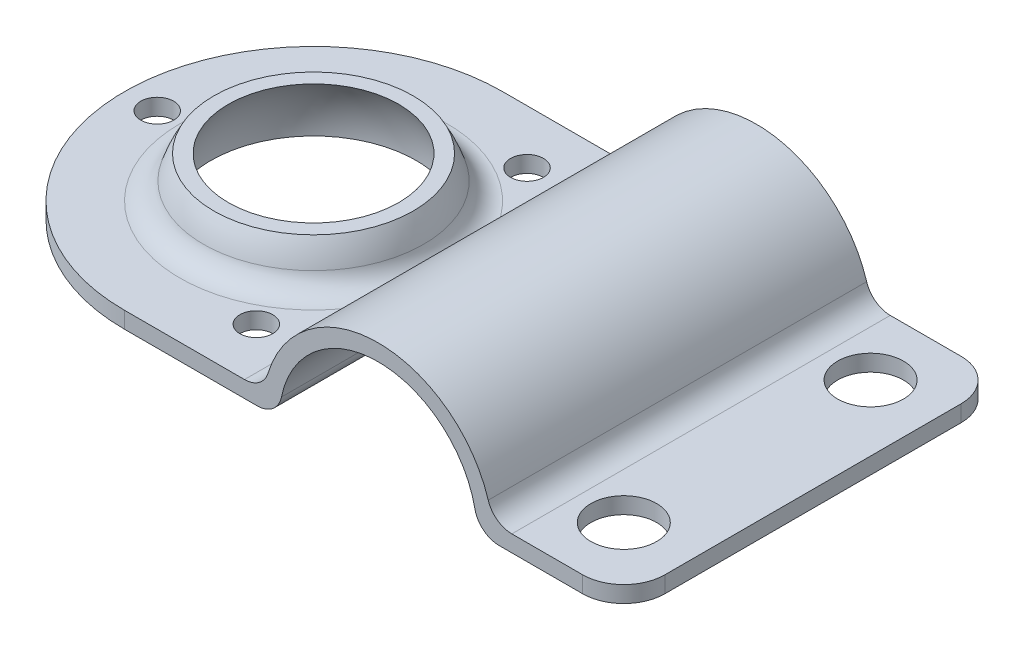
SolidWorks part; units mm, degrees
ref_plane "Face" through (0, 0, 0) normal (0, 0, 1) x (1, 0, 0)
ref_plane "Dessus" through (0, 0, 0) normal (0, 1, 0) x (1, 0, 0)
ref_plane "Droite" through (0, 0, 0) normal (1, 0, 0) x (0, 0, -1)
sketch "Esquisse1" plane through (0, 0, 0) normal (0, 0, 1) x (1, 0, 0)
  line L0 (-54.0174, 0) -> (-14.0174, 0)
  line L1 (13.6954, 0) -> (29.6954, 0)
  arc A0 (13.6954, 0) -> (-14.0174, 0) centre (-0.161, -2) ccw
  dimension "D1" = 2
  dimension "D4" = 28
  dimension "D2" = 16
  dimension "D3" = 40
extrude "Base-Extru.-Mince" add sketch "Esquisse1" along normal blind 46 thin
sketch "Esquisse2" plane through (0, 0, 0) normal (0, 1, 0) x (-1, 0, 0)
  line L0 (54.0174, 46) -> (14.0174, 46) construction
  line L1 (54.0174, 0) -> (14.0174, 0) construction
  line L2 (54.0174, 46) -> (54.0174, 0) construction
  line L3 (-29.6954, 0) -> (-29.6954, 46)
  line L4 (-29.6954, 46) -> (31.0174, 46)
  line L5 (31.0174, 0) -> (-29.6954, 0)
  arc A0 (31.0174, 0) -> (31.0174, 46) centre (31.0174, 23) ccw
extrude "Enlèv. mat.-Extru.5" cut sketch "Esquisse2" against normal blind 46 flip side to cut
fillet "Congé2" radius 3
fillet "Congé3" radius 3
fillet "Congé4" radius 3
fillet "Congé5" radius 5
sketch "Esquisse3" plane through (0, -2, 0) normal (0, -1, 0) x (1, 0, 0)
  line L0 (-17.0174, 23) -> (-24.9033, 23) construction
  line L1 (-17.0174, 23) -> (-45.0174, 23)
  arc A0 (-45.0174, 23) -> (-17.0174, 23) centre (-31.0174, 23) ccw
  dimension "D1" = 28
revolve "Boss.-Révol.1" add sketch "Esquisse3" angle 180 about L0
sketch "Esquisse4" plane through (0, -2, 0) normal (0, -1, 0) x (1, 0, 0)
  line L0 (-28.1823, 23) -> (-30.8952, 23) construction
  line L3 (-18.5174, 23) -> (-43.5174, 23)
  arc A0 (-43.5174, 23) -> (-18.5174, 23) centre (-31.0174, 23) ccw
  dimension "D1" = 25
revolve "Enlèvement de matière-Révolution1" cut sketch "Esquisse4" angle 360 about L0
fillet "Congé7" radius 3
sketch "Esquisse9" plane through (0, 0, 0) normal (0, 1, 0) x (1, 0, 0)
  line L0 (-31.0174, -53.7493) -> (-31.0174, 11.3537) construction
ref_plane "Plan1" through (-31.0174, 0, 0) normal (-1, 0, 0) x (0, 0, 1)
sketch "Esquisse10" plane through (-31.0174, 0, 0) normal (-1, 0, 0) x (0, 0, 1)
  line L0 (46, 2.1176) -> (46, 12) construction
  line L1 (0, 12) -> (46, 12)
  line L2 (0, 12) -> (0, 5)
  line L3 (0, 5) -> (46, 5)
  line L4 (46, 12) -> (46, 5)
  line L5 (0, 12) -> (0, 2.1176) construction
  line L6 (53.7493, 0) -> (-11.3537, 0) construction
  line L7 (46, 12) -> (0, 12) construction
  dimension "D1" = 5
extrude "Enlèv. mat.-Extru.7" cut sketch "Esquisse10" against normal up to next and the other way up to next
sketch "Esquisse11" plane through (0, 0, 0) normal (0, 1, 0) x (-1, 0, 0)
  line L0 (-21.6954, -6.2747) -> (-21.6954, 50.809) construction
  line L1 (-29.6954, 41) -> (-29.6954, 5) construction
  line L2 (-16.087, 0) -> (-24.6954, 0) construction
  line L3 (-16.087, 46) -> (-24.6954, 46) construction
  line L4 (1.5565, 23) -> (57.5318, 23) construction
  line L5 (31.0174, 46) -> (16.4091, 46) construction
  line L6 (31.0174, 0) -> (16.4091, 0) construction
  line L7 (31.0174, 53.7493) -> (31.0174, -11.3537) construction
  circle A0 centre (-21.6954, 8) radius 4
  circle A1 centre (-21.6954, 38) radius 4
  point P21 (31.0174, 23)
  point P25 (0, 0)
  point P26 (-39.6686, 22.708)
  dimension "D4" = 8
  dimension "D5" = 8
  dimension "D1" = 8
  dimension "D2" = 8
  dimension "D3" = 8
extrude "Enlèv. mat.-Extru.8" cut sketch "Esquisse11" against normal through all
sketch "Esquisse12" plane through (0, 0, 0) normal (0, 1, 0) x (-1, 0, 0)
  line L0 (15.9003, 23) -> (61.2265, 23) construction
  line L1 (31.0174, 46) -> (16.4091, 46) construction
  line L2 (31.0174, 0) -> (16.4091, 0) construction
  line L3 (31.0174, 53.7493) -> (31.0174, -11.3537) construction
  circle A0 centre (50.0174, 23) radius 2
  dimension "D1" = 4
  dimension "D2" = 19
extrude "Enlèv. mat.-Extru.9" cut sketch "Esquisse12" against normal through all
pattern_circular "Répétition circulaire1" count 3 every 120
